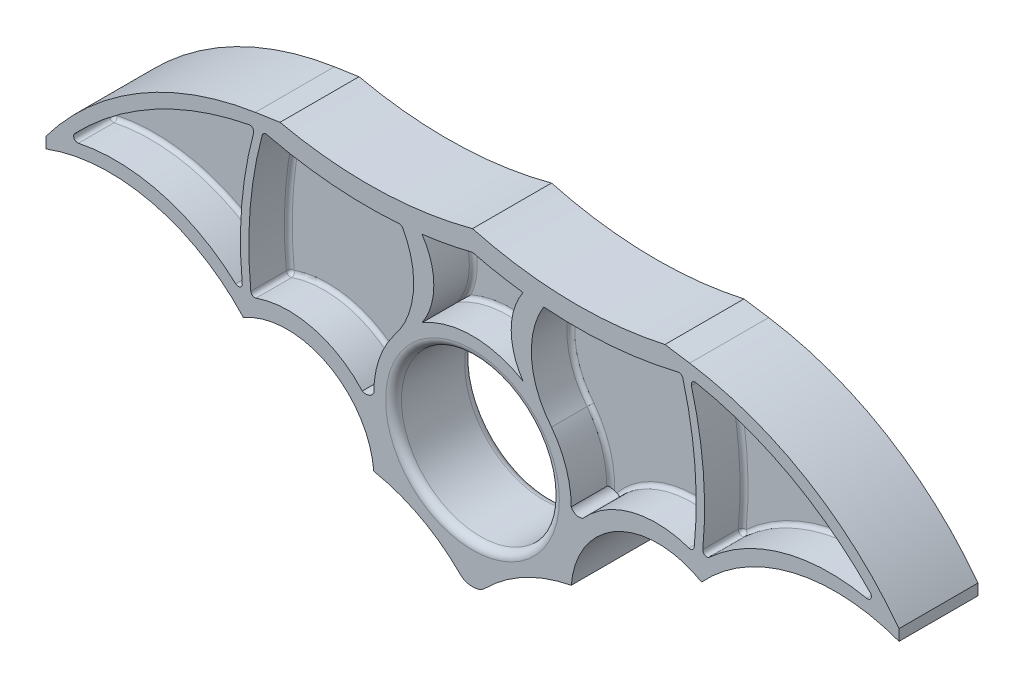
SolidWorks part; units mm, degrees
ref_plane "Front Plane" through (0, 0, 0) normal (0, 0, 1) x (1, 0, 0)
ref_plane "Top Plane" through (0, 0, 0) normal (0, 1, 0) x (1, 0, 0)
ref_plane "Right Plane" through (0, 0, 0) normal (1, 0, 0) x (0, 0, -1)
sketch "Sketch1" plane through (0, 0, 0) normal (0, 0, 1) x (1, 0, 0)
  line L0 (68.58, 0) -> (68.58, 76.2)
  line L1 (0, 0) -> (137.16, 0)
  line L2 (0, 0) -> (0, 76.2)
  line L3 (0, 76.2) -> (137.16, 76.2)
  line L4 (137.16, 0) -> (137.16, 76.2)
  line L5 (84.455, 19.05) -> (84.455, 0)
  line L6 (105.41, 76.2) -> (105.41, 0)
  line L7 (59.8445, 65.0965) -> (65.786, 71.9835)
  line L8 (103.505, 46.5545) -> (102.235, 46.5545)
  line L9 (103.505, 46.5545) -> (103.505, 48.5865)
  line L10 (103.505, 48.5865) -> (102.235, 48.5865)
  line L11 (102.235, 46.5545) -> (102.235, 48.5865)
  line L12 (102.235, 48.5865) -> (103.505, 48.5865)
  line L13 (102.235, 48.5865) -> (102.235, 49.8565)
  line L14 (102.235, 49.8565) -> (103.505, 49.8565)
  line L15 (103.505, 48.5865) -> (103.505, 49.8565)
  line L16 (65.786, 71.9835) -> (62.8153, 65.6045)
  line L17 (62.8153, 65.6045) -> (66.9565, 65.6045)
  line L18 (52.705, 19.05) -> (52.705, 15.8526)
  line L19 (33.655, 48.5865) -> (37.6341, 49.1919)
  line L20 (103.505, 48.5865) -> (99.5259, 49.1919)
  circle A0 centre (68.58, 19.05) radius 12.7
  circle A1 centre (68.58, 19.05) radius 15.875
  arc A2 (69.85, 0) -> (84.455, 8.128) centre (89.4686, -18.0665) cw
  arc A3 (84.455, 8.128) -> (105.41, 19.05) centre (98.3777, 6.9791) cw
  arc A4 (84.455, 15.8526) -> (105.41, 21.9165) centre (98.1556, 7.7465) cw
  arc A5 (105.41, 19.05) -> (137.16, 26.67) centre (126.9377, -0.6929) cw
  arc A6 (105.41, 21.9165) -> (137.16, 28.448) centre (126.0581, 1.98) cw
  arc A7 (137.16, 28.448) -> (103.505, 48.5865) centre (95.7139, -2.6247) ccw
  arc A8 (103.505, 46.5545) -> (133.985, 29.5657) centre (94.5213, -5.4001) cw
  arc A9 (103.505, 46.5545) -> (105.41, 21.9165) centre (44.6179, 29.6087) cw
  arc A10 (102.235, 46.5545) -> (104.14, 22.4978) centre (41.8613, 29.6699) cw
  arc A11 (102.235, 49.8565) -> (108.5799, 50.1105) centre (106.469, 23.4659) cw
  arc A12 (103.505, 48.5865) -> (109.093, 49.3485) centre (109.7334, 23.7821) cw
  arc A13 (108.5799, 50.1105) -> (109.093, 49.3485) centre (108.3321, 49.3899) cw
  arc A14 (102.235, 49.8565) -> (68.58, 49.8565) centre (85.4075, 112.5916) cw
  arc A15 (102.235, 46.5545) -> (68.58, 46.5545) centre (85.4075, 113.3765) cw
  arc A16 (81.28, 28.575) -> (80.01, 44.68) centre (92.0078, 37.5235) cw
  arc A17 (55.88, 28.575) -> (57.15, 44.68) centre (45.1522, 37.5235) ccw
  arc A18 (67.31, 0) -> (52.705, 8.128) centre (47.6914, -18.0665) ccw
  arc A19 (52.705, 8.128) -> (31.75, 19.05) centre (38.7823, 6.9791) ccw
  arc A20 (52.705, 15.8526) -> (31.75, 21.9165) centre (39.0044, 7.7465) ccw
  arc A21 (31.75, 19.05) -> (0, 26.67) centre (10.2223, -0.6929) ccw
  arc A22 (31.75, 21.9165) -> (0, 28.448) centre (11.1019, 1.98) ccw
  arc A23 (34.925, 46.5545) -> (33.02, 22.4978) centre (95.2987, 29.6699) ccw
  arc A24 (33.655, 46.5545) -> (31.75, 21.9165) centre (92.5421, 29.6087) ccw
  arc A25 (33.655, 46.5545) -> (3.175, 29.5657) centre (42.6387, -5.4001) ccw
  arc A26 (0, 28.448) -> (33.655, 48.5865) centre (41.4461, -2.6247) cw
  arc A27 (33.655, 48.5865) -> (28.067, 49.3485) centre (27.4266, 23.7821) ccw
  arc A28 (28.5801, 50.1105) -> (28.067, 49.3485) centre (28.8279, 49.3899) ccw
  arc A29 (34.925, 49.8565) -> (28.5801, 50.1105) centre (30.691, 23.4659) ccw
  arc A30 (34.925, 46.5545) -> (68.58, 46.5545) centre (51.7525, 113.3765) ccw
  arc A31 (34.925, 49.8565) -> (68.58, 49.8565) centre (51.7525, 112.5916) ccw
  arc A32 (74.93, 48.4895) -> (68.58, 65.0965) centre (63.1832, 53.5154) ccw
  arc A33 (68.58, 65.0965) -> (71.1962, 71.9835) centre (58.8616, 72.7287) ccw
  arc A34 (66.9565, 65.6045) -> (70.4342, 71.9835) centre (58.7382, 74.2224) ccw
  arc A35 (70.4342, 71.9835) -> (71.1962, 71.9835) centre (70.8152, 71.9835) cw
  circle A36 centre (59.5598, 60.678) radius 0.635
  arc A37 (86.3066, 18.3774) -> (84.455, 19.05) centre (85.7171, 19.6395) cw
  arc A38 (50.8534, 18.3774) -> (52.705, 19.05) centre (51.4429, 19.6395) ccw
  arc A39 (76.708, 32.6864) -> (76.708, 45.0196) centre (85.7226, 38.853) cw
  arc A40 (60.452, 32.6864) -> (60.452, 45.0196) centre (51.4374, 38.853) ccw
  spline S0 degree 2 poles (60.96, 48.2948) (69.6217, 53.5349) (61.468, 55.6686) knots 0 0 0 1 1 1
  spline S1 degree 3 poles (61.468, 55.6686) (58.8768, 56.2608) (58.4711, 52.8685) (54.2924, 51.8809) (51.6267, 55.4286) (56.5362, 59.5219) (57.1373, 63.5085) (59.8445, 65.0965) knots 0 0 0 0 0.225896 0.335052 0.466531 0.65053 1 1 1 1
  point P49 (68.58, 38.1)
  dimension "D3" = 25.4
  dimension "D5" = 31.75
  dimension "D6" = 1.27
  dimension "D8" = 26.67
  dimension "D10" = 19.05
  dimension "D11" = 13.97
  dimension "D12" = 16.51
  dimension "D14" = 15.919
  dimension "D15" = 7.62
  dimension "D16" = 29.21
  dimension "D17" = 28.702
  dimension "D18" = 1.905
  dimension "D20" = 51.8005
  dimension "D22" = 3.175
  dimension "D25" = 52.7256
  dimension "D26" = 1.27
  dimension "D27" = 1.27
  dimension "D28" = 62.6903
  dimension "D29" = 61.2768
  dimension "D33" = 6.35
  dimension "D34" = 5.588
  dimension "D37" = 25.5744
  dimension "D38" = 26.7281
  dimension "D39" = 0.762
  dimension "D40" = 3.302
  dimension "D41" = 68.9083
  dimension "D44" = 12.7
  dimension "D46" = 13.97
  dimension "D42" = 64.9528
  dimension "D47" = 12.7768
  dimension "D50" = 0.508
  dimension "D55" = 0.381
  dimension "D57" = 11.9083
  dimension "D58" = 12.3571
  dimension "D63" = 1.27
  dimension "D64" = 8.128
  dimension "D66" = 10.922
  dimension "D1" = 137.16
  dimension "D2" = 76.2
  dimension "D4" = 19.05
  dimension "D7" = 8.128
  dimension "D9" = 31.75
  dimension "D13" = 16.51
  dimension "D19" = 1.778
  dimension "D21" = 26.67
  dimension "D23" = 0
  dimension "D24" = 2.032
  dimension "D30" = 1.27
  dimension "D31" = 1.27
  dimension "D32" = 2.032
  dimension "D35" = 0.762
  dimension "D36" = 0.254
  dimension "D43" = 8.4545
  dimension "D45" = 11.43
  dimension "D48" = 6.35
  dimension "D49" = 15.24
  dimension "D51" = 0
  dimension "D52" = 2.6162
  dimension "D53" = 1.8542
  dimension "D54" = 4.2165
  dimension "D56" = 1.6235
  dimension "D59" = 7.62
  dimension "D60" = 3.302
  dimension "D61" = 7.112
  dimension "D62" = 7.112
  dimension "D65" = 8.128
extrude "Boss-Extrude1" add sketch "Sketch1" along normal blind 12.7 contours A31 A29 A28 A27 A26 A22 A25 A24 A20 A23 A30 L0 | A20 A22 L2 A21 A19 A18 L1 L0 A1 L18 | A38 A20 L18 | A17 A1 L0 A0 | A1 A16 L0 A0 | L1 A2 L5 A1 L0 | A4 A37 L5 | A4 L5 A3 L6 | A6 L6 A5 L4 | L6 A8 A6 A7 | L8 A10 A4 L6 A9 | A9 L6 | L11 L8 L9 L10 | L9 A8 L6 A7 | A15 L11 L13 A14 L0 | L10 L20 L13 | A1 A40 A30 A17 | A39 A1 A16 A15
sketch "Sketch2" plane through (0, 0, 0) normal (0, 0, -1) x (-1, 0, 0)
  arc A0 (-57.15, 44.68) -> (-34.925, 46.5545) centre (-51.7525, 113.3765) ccw
  arc A1 (-33.02, 22.4978) -> (-34.925, 46.5545) centre (-95.2987, 29.6699) ccw
  arc A2 (-50.8534, 18.3774) -> (-33.02, 22.4978) centre (-39.0044, 7.7465) cw
  arc A3 (-52.705, 19.05) -> (-50.8534, 18.3774) centre (-51.4429, 19.6395) ccw
  arc A4 (-52.705, 19.05) -> (-55.88, 28.575) centre (-68.58, 19.05) ccw
  arc A5 (-55.88, 28.575) -> (-57.15, 44.68) centre (-45.1522, 37.5235) cw
  arc A6 (-33.655, 46.5545) -> (-3.175, 29.5657) centre (-42.6387, -5.4001) cw
  arc A7 (-31.75, 21.9165) -> (-3.175, 29.5657) centre (-11.1019, 1.98) cw
  arc A8 (-31.75, 21.9165) -> (-33.655, 46.5545) centre (-92.5421, 29.6087) ccw
  arc A9 (-102.235, 46.5545) -> (-80.01, 44.68) centre (-85.4075, 113.3765) ccw
  arc A10 (-80.01, 44.68) -> (-81.28, 28.575) centre (-92.0078, 37.5235) cw
  arc A11 (-84.455, 19.05) -> (-81.28, 28.575) centre (-68.58, 19.05) cw
  arc A12 (-86.3066, 18.3774) -> (-84.455, 19.05) centre (-85.7171, 19.6395) ccw
  arc A13 (-86.3066, 18.3774) -> (-104.14, 22.4978) centre (-98.1556, 7.7465) ccw
  arc A14 (-104.14, 22.4978) -> (-102.235, 46.5545) centre (-41.8613, 29.6699) cw
  arc A15 (-103.505, 46.5545) -> (-133.985, 29.5657) centre (-94.5213, -5.4001) ccw
  arc A16 (-133.985, 29.5657) -> (-105.41, 21.9165) centre (-126.0581, 1.98) cw
  arc A17 (-105.41, 21.9165) -> (-103.505, 46.5545) centre (-44.6179, 29.6087) cw
  arc A18 (-68.58, 46.5545) -> (-60.452, 45.0196) centre (-51.7525, 113.3765) ccw
  arc A19 (-60.452, 32.6864) -> (-60.452, 45.0196) centre (-51.4374, 38.853) cw
  arc A20 (-60.452, 32.6864) -> (-76.708, 32.6864) centre (-68.58, 19.05) ccw
  arc A21 (-76.708, 45.0196) -> (-76.708, 32.6864) centre (-85.7226, 38.853) cw
  arc A22 (-76.708, 45.0196) -> (-68.58, 46.5545) centre (-85.4075, 113.3765) ccw
extrude "Boss-Extrude2" add sketch "Sketch2" against normal blind 6.35
fillet "Fillet2" radius 2.54 2 edges at (69.85, 0, 6.35) (67.31, 0, 6.35)
fillet "Fillet7" radius 0.635 11 edges at (133.985, 29.5657, 9.525) (105.41, 21.9165, 9.525) (104.14, 22.4978, 9.525) (103.505, 46.5545, 9.525) (102.235, 46.5545, 9.525) (3.175, 29.5657, 9.525) (57.15, 44.68, 9.525) (33.02, 22.4978, 9.525) (34.925, 46.5545, 9.525) (33.655, 46.5545, 9.525) (31.75, 21.9165, 9.525)
fillet "Fillet9" radius 1.27 2 edges at (81.28, 19.05, 12.7) (81.28, 19.05, 0)
fillet "Fillet10" radius 0.635 29 edges at (105.9548, 23.0415, 6.35) (118.4721, 29.6614, 6.35) (132.6373, 30.3841, 6.35) (119.705, 40.9224, 6.35) (103.9242, 46.1795, 6.35) (90.8918, 44.6869, 6.35) (102.1102, 46.3358, 6.35) (104.3479, 34.7189, 6.35) (103.9382, 22.845, 6.35) (31.2052, 23.0415, 6.35) (31.4779, 34.7092, 6.35) (33.2358, 46.1795, 6.35) (17.455, 40.9224, 6.35) (4.5227, 30.3841, 6.35) (33.2218, 22.845, 6.35) (46.0701, 44.703, 6.35) (35.0498, 46.3358, 6.35) (105.6821, 34.7092, 6.35) (94.1818, 23.1616, 6.35) (83.6403, 24.0701, 6.35) (78.081, 36.4253, 6.35) (18.6879, 29.6614, 6.35) (42.9782, 23.1616, 6.35) (32.8121, 34.7189, 6.35) (72.6209, 45.665, 6.35) (64.5391, 45.665, 6.35) (68.58, 34.925, 6.35) (62.3594, 38.853, 6.35) (74.8006, 38.853, 6.35)
